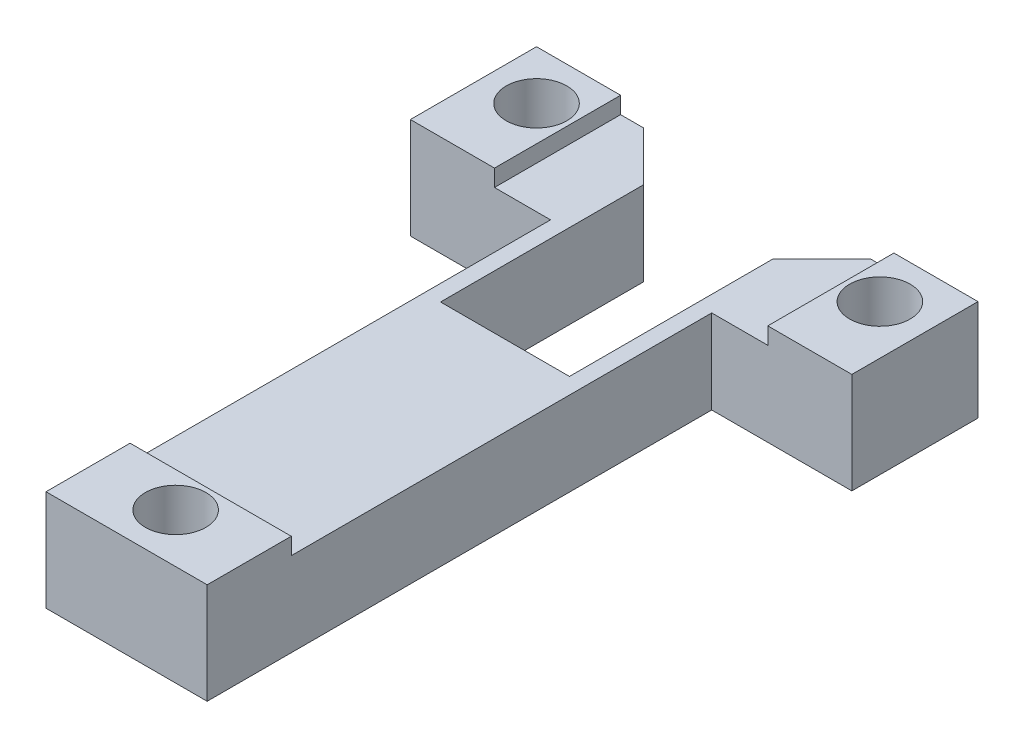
SolidWorks part; units mm, degrees
ref_plane "Front Plane" through (0, 0, 0) normal (0, 0, 1) x (1, 0, 0)
ref_plane "Top Plane" through (0, 0, 0) normal (0, 1, 0) x (1, 0, 0)
ref_plane "Right Plane" through (0, 0, 0) normal (1, 0, 0) x (0, 0, -1)
sketch "Sketch1" plane through (0, 0, 0) normal (0, 1, 0) x (1, 0, 0)
  line L0 (11.5, 45) -> (21.5, 45)
  line L1 (0, 0) -> (11.5, 0)
  line L2 (0, 0) -> (0, 45)
  line L3 (0, 45) -> (11.5, 45)
  line L4 (11.5, 0) -> (11.5, 45)
  line L5 (21.5, 45) -> (21.5, 36)
  line L6 (21.5, 36) -> (11.5, 36)
  line L7 (0, 45) -> (-10, 45)
  line L8 (-10, 45) -> (-10, 36)
  line L9 (-10, 36) -> (0, 36)
  dimension "D3" = 9
  dimension "D1" = 45
  dimension "D2" = 11.5
  dimension "D4" = 10
  dimension "D5" = 10
extrude "Boss-Extrude1" add sketch "Sketch1" along normal blind 6 contours L8 L9 L2 L7 | L6 L5 L0 L4
sketch "Sketch3" plane through (0, 6, 0) normal (0, 1, 0) x (1, 0, 0)
  line L0 (-4, 45) -> (-4, 36)
  line L1 (21.5, 45) -> (-10, 45) construction
  line L2 (-10, 36) -> (0, 36) construction
  line L3 (15.5, 45) -> (15.5, 36)
  line L4 (21.5, 45) -> (-10, 45) construction
  line L5 (21.5, 36) -> (11.5, 36) construction
  line L6 (-10, 45) -> (-10, 36) construction
  line L7 (21.5, 45) -> (21.5, 36) construction
  line L8 (0, 6) -> (11.5, 6)
  line L9 (0, 0) -> (0, 36) construction
  line L10 (11.5, 0) -> (11.5, 36) construction
  line L11 (0, 0) -> (11.5, 0) construction
  line L12 (-4, 45) -> (-10, 45)
  line L14 (-10, 36) -> (-4, 36)
  line L15 (15.5, 36) -> (21.5, 36)
  line L16 (21.5, 36) -> (21.5, 45)
  line L17 (21.5, 45) -> (15.5, 45)
  line L18 (0, 6) -> (0, 0)
  line L19 (-10, 45) -> (-10, 36)
  line L20 (0, 0) -> (11.5, 0)
  line L21 (11.5, 0) -> (11.5, 6)
  dimension "D1" = 6
  dimension "D2" = 6
  dimension "D3" = 6
extrude "Boss-Extrude2" add sketch "Sketch3" along normal blind 1.2
sketch "Sketch2" plane through (0, 6, 0) normal (0, 1, 0) x (1, 0, 0)
  line L0 (5.75, 0) -> (5.75, 45) construction
  line L3 (0, 36) -> (11.5, 36) construction
  line L4 (5.75, 36) -> (5.75, 27)
  line L5 (1.15, 27) -> (10.35, 27)
  line L6 (1.15, 27) -> (1.15, 45)
  line L7 (15.5, 45) -> (-4, 45) construction
  line L8 (10.35, 27) -> (10.35, 45)
  line L9 (1.15, 45) -> (10.35, 45)
  line L10 (0, 0) -> (11.5, 0) construction
  line L11 (-10, 45) -> (-10, 36) construction
  line L12 (21.5, 45) -> (21.5, 36) construction
  line L13 (1.15, 41.5) -> (-2.35, 45)
  line L14 (10.35, 41.5) -> (13.85, 45)
  circle A0 centre (5.75, 3.5) radius 2.16
  circle A1 centre (-6.5, 41.5) radius 2.16
  circle A2 centre (18, 41.5) radius 2.16
  point P17 (5.75, 27)
  dimension "D1" = 4.32
  dimension "D9" = 4.32
  dimension "D10" = 4.32
  dimension "D2" = 9
  dimension "D3" = 9.2
  dimension "D4" = 3.5
  dimension "D5" = 3.5
  dimension "D6" = 3.5
  dimension "D7" = 3.5
  dimension "D8" = 3.5
  dimension "D11" = 3.5
  dimension "D12" = 3.5
  dimension "D13" = 3.5
  dimension "D14" = 3.5
extrude "Cut-Extrude1" cut sketch "Sketch2" against normal blind 11 and the other way through all
